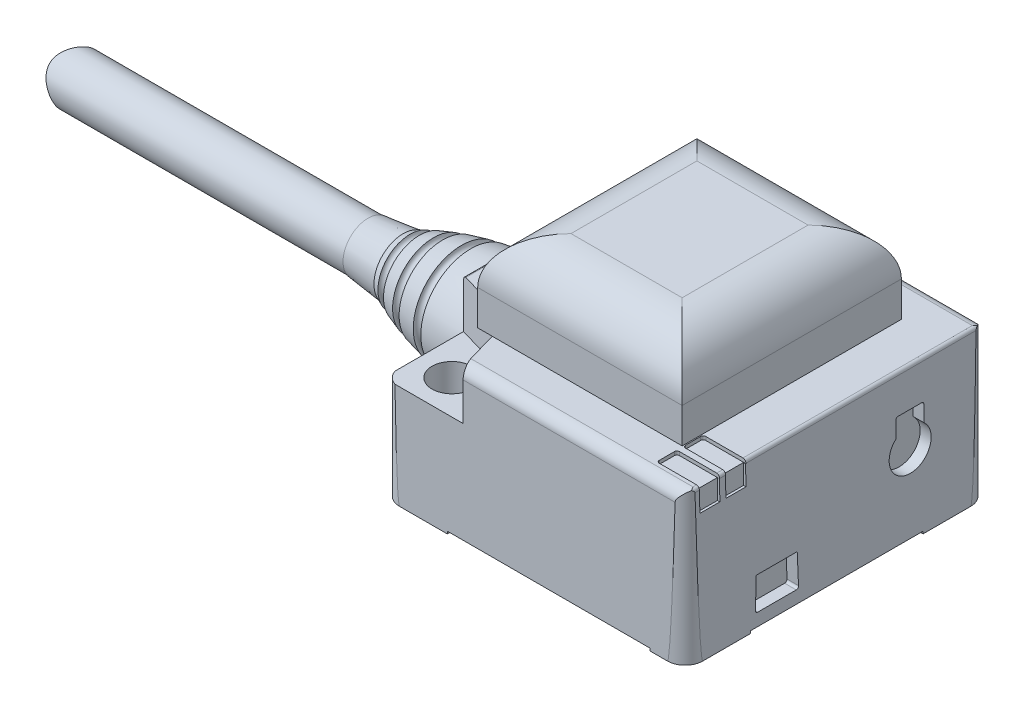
SolidWorks part; units mm, degrees
ref_plane "Plan de face" through (0, 0, 0) normal (0, 0, 1) x (1, 0, 0)
ref_plane "Plan de dessus" through (0, 0, 0) normal (0, 1, 0) x (1, 0, 0)
ref_plane "Plan de droite" through (0, 0, 0) normal (1, 0, 0) x (0, 0, -1)
imported_body "Importée1"
sketch "Esquisse1" plane through (0, 13, 0) normal (0, 1, 0) x (-1, 0, 0)
  line L0 (-25.6406, 7.6808) -> (-25.6406, -11.9784) construction
  line L1 (-22.1406, -9.3987) -> (-4.6097, -9.3987)
  line L2 (-22.1406, -9.3987) -> (-22.1406, 9.3952)
  line L3 (-22.1406, 9.3952) -> (-4.6097, 9.3952)
  line L4 (-4.6097, -9.3987) -> (-4.6097, 9.3952)
  line L5 (-6.8604, 12.8952) -> (-25.0346, 12.8952) construction
  line L6 (-25.0256, -12.8987) -> (-6.9093, -12.8987) construction
  line L7 (-0.1097, 6.0931) -> (-0.1097, -6.141) construction
  dimension "D1" = 3.5
  dimension "D2" = 3.5
  dimension "D3" = 3.5
  dimension "D4" = 4.5
extrude "Extrusion1" add sketch "Esquisse1" along normal blind 7
fillet "Congé1" radius 4 4 edges at (4.6097, 20, -0.0017) (13.3752, 20, 9.3952) (22.1406, 20, -0.0017) (13.3752, 20, -9.3987)
